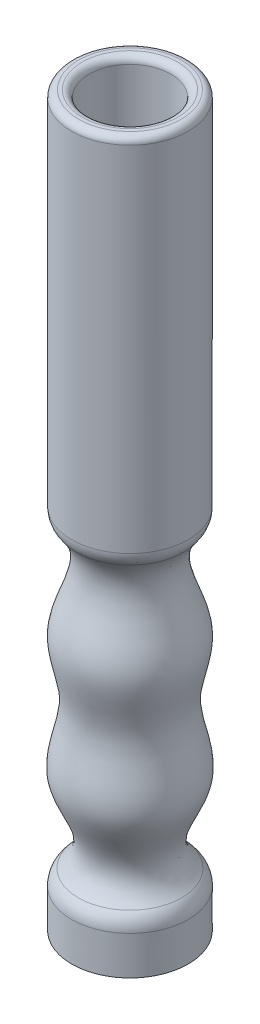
SolidWorks part; units mm, degrees
ref_plane "Plan de face" through (0, 0, 0) normal (0, 0, 1) x (1, 0, 0)
ref_plane "Plan de dessus" through (0, 0, 0) normal (0, 1, 0) x (1, 0, 0)
ref_plane "Plan de droite" through (0, 0, 0) normal (1, 0, 0) x (0, 0, -1)
sketch "Esquisse1" plane through (0, 0, 0) normal (0, 0, 1) x (1, 0, 0)
  line L1 (-8.375, 58.3594) -> (-5.875, 58.3594)
  line L2 (-5.875, 58.3594) -> (-5.875, 23.8281)
  line L3 (-5.875, 23.8281) -> (0, 23.8281)
  line L4 (0, 23.8281) -> (0, -46.3281)
  line L5 (0, -46.3281) -> (-8.375, -46.3281)
  line L6 (0, 80.2344) -> (0, -67.8906) construction
  line L7 (-8.375, 58.3594) -> (-8.375, 5.3478)
  line L8 (-8.375, -46.3281) -> (-8.3902, -39.3397)
  spline S0 degree 3 poles (-8.375, 5.3478) (-3.1843, 0.2235) (-10.9764, -7.0587) (-5.5818, -17.9048) (-11.3057, -28.4528) (-2.655, -35.2265) (-8.3902, -39.3397) knots 0 0 0 0 0.320571 0.505671 0.710917 1 1 1 1
  dimension "D6" = 47.4474
  dimension "D1" = 2.5
  dimension "D2" = 0
  dimension "D3" = 5.875
  dimension "D4" = 8.375
  dimension "D5" = 6.9884
revolve "Révolution2" add sketch "Esquisse1" angle 360 about L6
fillet "Congé1" radius 3 2 edges at (0, -39.3397, 8.3902) (0, 5.3478, 8.375)
fillet "Congé3" radius 1 2 edges at (0, 58.3594, 5.875) (0, 58.3594, 8.375)
